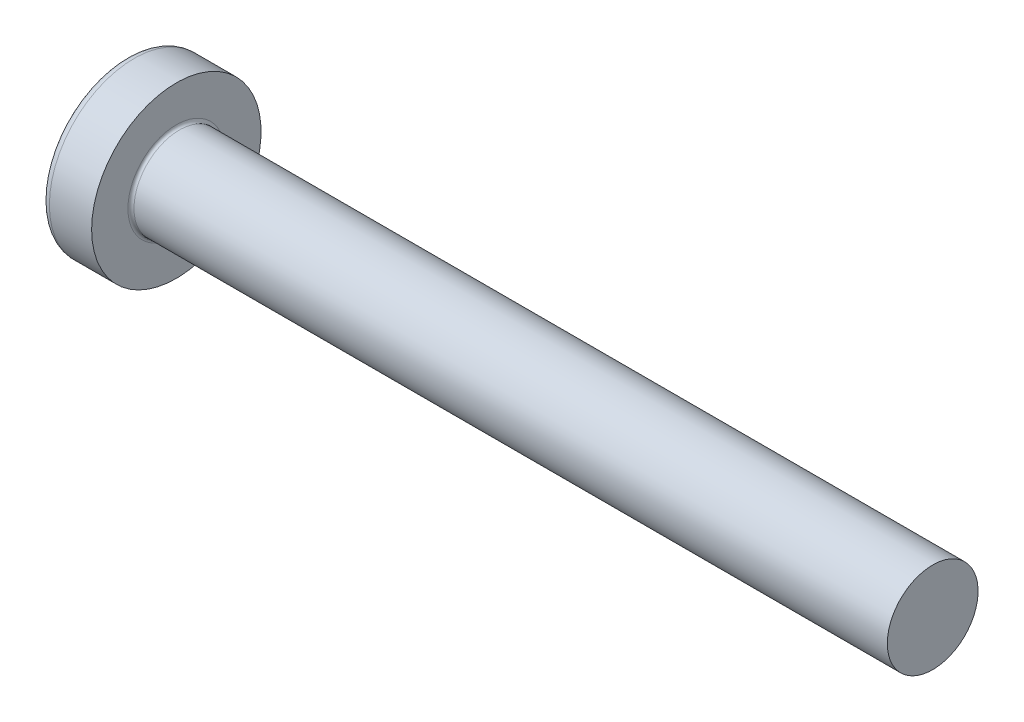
SolidWorks part; units mm, degrees
ref_plane "Plane1" through (0, 0, 0) normal (0, 0, 1) x (1, 0, 0)
ref_plane "Plane2" through (0, 0, 0) normal (0, 1, 0) x (1, 0, 0)
ref_plane "Plane3" through (0, 0, 0) normal (1, 0, 0) x (0, 0, -1)
sketch "BodySke" plane through (0, 0, 0) normal (0, 0, 1) x (1, 0, 0)
  line L0 (2.4, 1.5) -> (2.4, 2.8)
  line L1 (2.65, 6.35) -> (2.65, -3.175) construction
  line L2 (-25.4, 0) -> (127, 0) construction
  line L3 (27.4, 0) -> (0, 0)
  line L4 (2.4, 1.5) -> (27.4, 1.5)
  line L5 (27.4, 1.5) -> (27.4, 0)
  line L6 (1.0035, 2.8) -> (2.4, 2.8)
  line L8 (2.4, 6.35) -> (2.4, -3.175) construction
  arc A0 (0.7754, 2.6744) -> (0, 0) centre (5, 0) ccw
  arc A2 (0.7754, 2.6744) -> (1.0035, 2.8) centre (1.0035, 2.53) cw
  dimension "Head_fillet_rad" = 0.27
  dimension "Head_crown_rad" = 5
  dimension "Head_ht" = 2.4
  dimension "Diameter" = 3
  dimension "Length" = 25
  dimension "Head_dia" = 5.6
  dimension "Advance" = 0.5
  dimension "Thread_nom" = 25
revolve "Base-Revolve" add sketch "BodySke"
fillet "Fillet1" radius 0.1 1 edges at (2.4, 0, 1.5)
sketch "Sketch3" plane through (0, 0, 0) normal (1, 0, 0) x (0, 0, -1)
  line L0 (0.37, -1.4) -> (-0.37, -1.4)
  line L1 (0.37, -1.4) -> (0.37, 1.4)
  line L2 (-0.37, 1.4) -> (0.37, 1.4)
  line L3 (-0.37, 1.4) -> (-0.37, -1.4)
  dimension "D1" = 1.4
  dimension "Cross_dia" = 2.8
  dimension "D2" = 0.37
  dimension "Cross_width" = 0.74
ref_plane "Plane4" through (1.75, 0, 0) normal (1, 0, 0) x (0, 0, -1)
sketch "Sketch4" plane through (1.75, 0, 0) normal (1, 0, 0) x (0, 0, -1)
  line L0 (0.37, -0.5275) -> (-0.37, -0.5275)
  line L1 (0.37, -0.5275) -> (0.37, 0.5275)
  line L2 (-0.37, 0.5275) -> (0.37, 0.5275)
  line L3 (-0.37, 0.5275) -> (-0.37, -0.5275)
  dimension "D1" = 0.74
  dimension "D2" = 1.055
  dimension "D3" = 0.37
  dimension "D4" = 0.5275
loft "Recess" cut profiles "Sketch3", "Sketch4"
pattern_circular "RecPat" count 2 every 90 about axis through (0, 0, 0) along (1, 0, 0) of "Recess"
sketch "RecCorSke" plane through (0, 0, 0) normal (0, 0, 1) x (1, 0, 0)
  line L0 (-3.175, 0) -> (15.875, 0) construction
  line L1 (-25.4, 0) -> (127, 0) construction
  line L2 (0, 0) -> (0, 0.6784)
  line L3 (0, 0.6784) -> (1.75, 0.556)
  line L4 (1.75, 0.556) -> (1.9307, 0)
  line L5 (1.9307, 0) -> (0, 0)
  dimension "Diameter" = 1.112
  dimension "Depth" = 1.75
  dimension "Draft_angle" = 4
  dimension "Bottom_angle" = 18
revolve "RecessCore" cut sketch "RecCorSke" angle 360 about L0
sketch "ThdSchSke" plane through (0, 0, 0) normal (0, 0, 1) x (1, 0, 0)
  line L0 (3.4, -1.2195) -> (3.2036, -1.5)
  line L1 (3.4, -1.2195) -> (3.5964, -1.5)
  line L2 (3.5964, -1.5) -> (3.5964, -1.875)
  line L3 (-3.175, 0) -> (5.1513, 0) construction
  line L5 (3.5964, -1.875) -> (3.2036, -1.875)
  line L6 (3.2036, -1.875) -> (3.2036, -1.5)
  dimension "Thread_minor" = 2.439
  dimension "Diameter" = 3
  dimension "Start" = 3.4
  dimension "SideAngle" = 55
  dimension "VeeAngle" = 70
  dimension "Overcut" = 3.75
revolve "ThreadSchematic" [suppressed] cut sketch "ThdSchSke" angle 360 about L3
pattern_linear "ThdSchPat" [suppressed]
equation "\"D1@Sketch3\" = \"Cross_dia@Sketch3\" / 2"
equation "\"D2@Sketch3\" = \"Cross_width@Sketch3\" / 2"
equation "\"Depth@RecCorSke\" = \"Cross_depth@Plane4\""
equation "\"D1@Sketch4\" = \"Cross_width@Sketch3\""
equation "\"D2@Sketch4\" = \"Cross_dia@Sketch3\" - 2.0 * \"Cross_depth@Plane4\" * tan(26.5  * 0.017453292)"
equation "\"D3@Sketch4\" = \"D1@Sketch4\" / 2"
equation "\"D4@Sketch4\" = \"D2@Sketch4\" / 2"
equation "\"Thread_length@ThreadCosmetic\" = ((sgn( (\"Length@BodySke\" - \"Advance@BodySke\" * 2.0 ) - \"Thread_nom@BodySke\" )-1)*( (\"Length@BodySke\" - \"Advance@BodySke\" * 2.0 ) - \"Thread_nom@BodySke\" ))/-2+ \"Thread_"
equation "\"Thread_minor@ThdSchSke\" = \"Thread_minor@ThreadCosmetic\""
equation "\"Diameter@ThdSchSke\" = \"Diameter@BodySke\""
equation "\"Overcut@ThdSchSke\" = \"Diameter@BodySke\" * 1.25"
equation "\"Start@ThdSchSke\" = \"Head_ht@BodySke\" + \"Length@BodySke\" - \"Thread_length@ThreadCosmetic\"  '---Non-countersunk---"
equation "\"Num_threads@ThdSchPat\" = int( \"Thread_length@ThreadCosmetic\" / \"Advance@BodySke\" + 0.999 )  + 1"
equation "\"Advance@ThdSchPat\" = \"Thread_length@ThreadCosmetic\" /  (\"Num_threads@ThdSchPat\" - 1) 'relax it"
